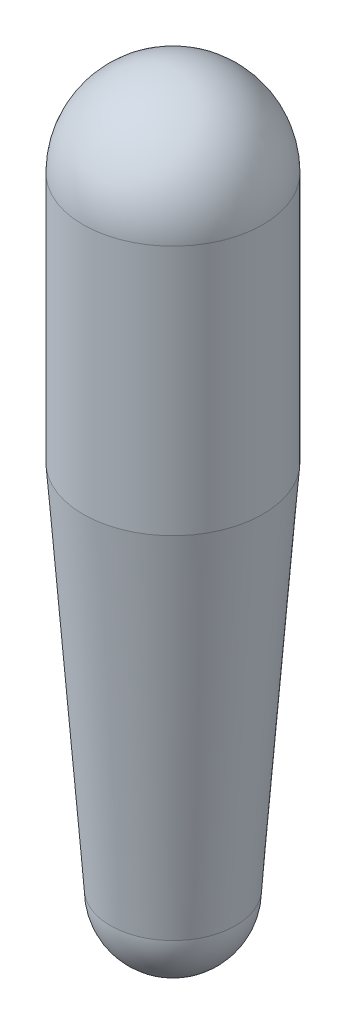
SolidWorks part; units mm, degrees
ref_plane "Front Plane" through (0, 0, 0) normal (0, 0, 1) x (1, 0, 0)
ref_plane "Top Plane" through (0, 0, 0) normal (0, 1, 0) x (1, 0, 0)
ref_plane "Right Plane" through (0, 0, 0) normal (1, 0, 0) x (0, 0, -1)
sketch "Sketch1" plane through (0, 0, 0) normal (0, 0, 1) x (1, 0, 0)
  line L0 (-54.61, 0) -> (54.61, 0)
  arc A0 (54.61, 0) -> (-54.61, 0) centre (0, 0) ccw
  dimension "D1" = 109.22
revolve "Revolve1" add sketch "Sketch1" angle 360 about L0
sketch "Sketch2" plane through (0, 0, 0) normal (0, 0, 1) x (1, 0, 0)
  line L0 (-38.1, -377.19) -> (38.1, -377.19)
  arc A0 (-38.1, -377.19) -> (38.1, -377.19) centre (0, -377.19) ccw
  arc A1 (54.61, 0) -> (-54.61, 0) centre (0, 0) ccw construction
  dimension "D1" = 76.2
  dimension "D2" = 469.9
revolve "Revolve2" add sketch "Sketch2" angle 360 about L0
sketch "Sketch3" plane through (0, 0, 0) normal (1, 0, 0) x (0, 0, -1)
  line L0 (0, 0) -> (0, -377.19)
  line L1 (0, -377.19) -> (38.1, -377.19)
  line L2 (38.1, -377.19) -> (54.61, 0) construction
  line L3 (54.61, 0) -> (0, 0)
  line L4 (54.61, 0) -> (54.61, -152.4)
  line L5 (54.61, -152.4) -> (38.1, -377.19)
  circle A0 centre (0, 0) radius 54.61 construction
  circle A1 centre (0, -377.19) radius 38.1 construction
  dimension "D2" = 152.4
revolve "Revolve3" add sketch "Sketch3" angle 360 about L0
